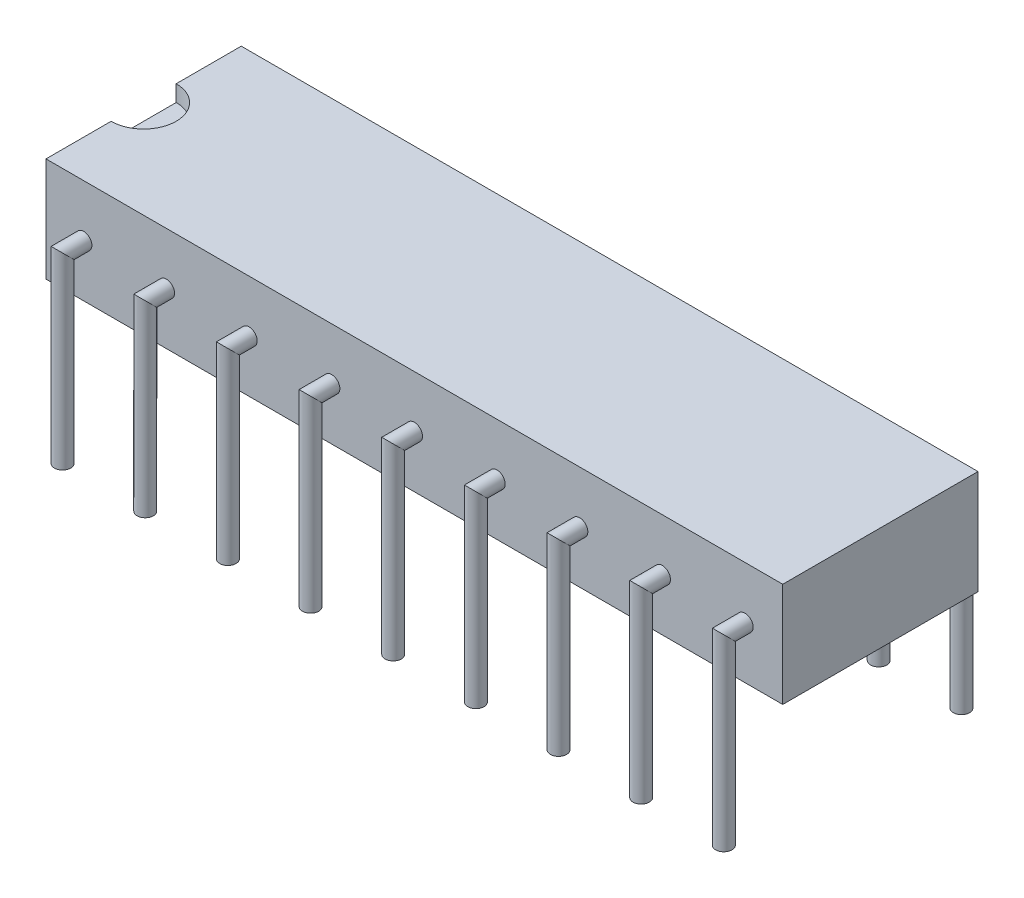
SolidWorks part; units mm, degrees
ref_plane "Plan de face" through (0, 0, 0) normal (0, 0, 1) x (1, 0, 0)
ref_plane "Plan de dessus" through (0, 0, 0) normal (0, 1, 0) x (1, 0, 0)
ref_plane "Plan de droite" through (0, 0, 0) normal (1, 0, 0) x (0, 0, -1)
sketch "Esquisse1" plane through (0, 0, 0) normal (1, 0, 0) x (0, 0, -1)
  line L0 (-34.0084, 0) -> (28.7946, 0) construction
  line L1 (0, -15.76) -> (0, 25.9507) construction
  line L2 (-13.1897, 3.2) -> (13.1184, 3.2) construction
  line L3 (3, 10.112) -> (3, -6.1718) construction
  line L4 (-3, 10.112) -> (-3, -4.99) construction
  line L6 (-3, 3.2) -> (3, 3.2)
  line L7 (-3, 3.2) -> (-3, 0)
  line L8 (-3, 0) -> (3, 0)
  line L9 (3, 3.2) -> (3, 0)
  dimension "D1" = 3
  dimension "D2" = 6
  dimension "D3" = 3.2
extrude "Extrusion1" add sketch "Esquisse1" along normal blind 22.64
sketch "Esquisse2" plane through (0, 3.2, 0) normal (0, 1, 0) x (-1, 0, 0)
  line L0 (0, -1) -> (0, 1)
  arc A0 (0, 1) -> (0, -1) centre (0, 0) ccw
extrude "Enlèv. mat.-Extru.1" cut sketch "Esquisse2" against normal blind 0.5
sketch "Esquisse3" plane through (0, 0, 3) normal (0, 0, 1) x (1, 0, 0)
  line L0 (-0.9705, 0) -> (10.7632, 0) construction
  line L1 (0, 4.319) -> (0, -1.0907) construction
  line L2 (-0.7349, 1.6) -> (2.3847, 1.6) construction
  line L3 (1.16, 2.698) -> (1.16, -1.0907) construction
  circle A0 centre (1.16, 1.6) radius 0.25
  dimension "D1" = 1.6
  dimension "D2" = 1.16
ref_plane "Plan1" through (1.16, 0, 0) normal (1, 0, 0) x (0, 0, -1)
sketch "Esquisse5" plane through (1.16, 0, 0) normal (1, 0, 0) x (0, 0, -1)
  line L0 (-4.2866, 0) -> (4.976, 0) construction
  line L1 (-3, -1.7147) -> (-3, 5.2592) construction
  line L2 (-4.2866, -4) -> (4.976, -4) construction
  line L3 (-3.65, -4.4343) -> (-3.65, 4.8284) construction
  line L4 (-3.7349, 1.6) -> (-3, 1.6) construction
  line L5 (-3, 1.6) -> (-3.65, 1.6)
  line L6 (-3.65, 1.6) -> (-3.65, -4)
  dimension "D1" = 4
  dimension "D2" = 0.65
sweep "Balayage1" add profiles "Esquisse3" path "Esquisse5"
ref_plane "Plan2" through (0, 0, 0) normal (0, 0, 1) x (1, 0, 0)
mirror "Symétrie1" about plane through (0, 0, 0) normal (0, 0, 1) of "Balayage1"
pattern_linear "Répétition linéaire1" count 9 spacing 2.54 along (1, 0, 0) of "Balayage1", "Symétrie1"
